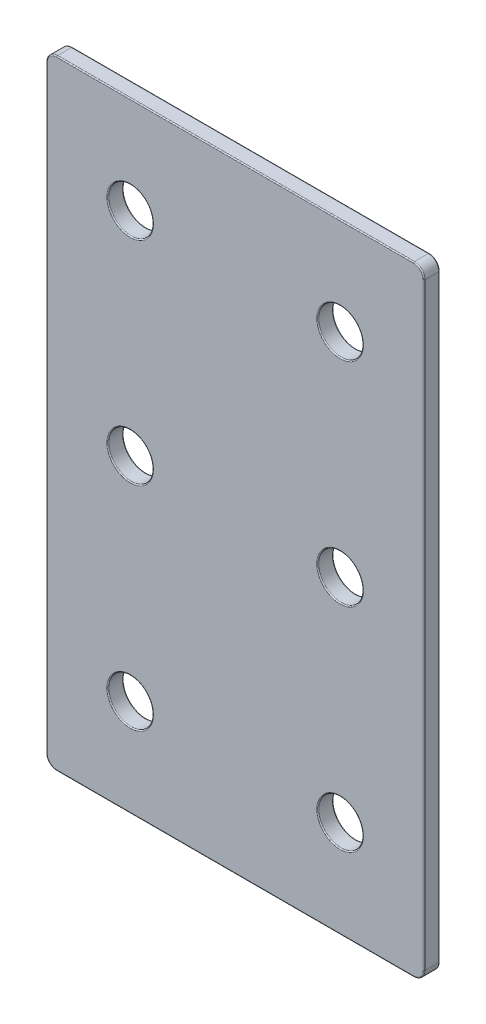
SolidWorks part; units mm, degrees
ref_plane "前视基准面" through (0, 0, 0) normal (0, 0, 1) x (1, 0, 0)
ref_plane "上视基准面" through (0, 0, 0) normal (0, 1, 0) x (1, 0, 0)
ref_plane "右视基准面" through (0, 0, 0) normal (1, 0, 0) x (0, 0, -1)
sketch "草图1" plane through (0, 0, 0) normal (0, 0, 1) x (1, 0, 0)
  line L1 (-36, 59) -> (36, 59)
  line L2 (-36, 59) -> (-36, -59)
  line L3 (-36, -59) -> (36, -59)
  line L4 (36, 59) -> (36, -59)
  line L5 (-36, 59) -> (36, -59) construction
  line L6 (-36, -59) -> (36, 59) construction
  point P0 (0, 0)
  dimension "D1" = 72
  dimension "D2" = 118
extrude "凸台-拉伸1" add sketch "草图1" along normal mid plane 3
sketch "草图2" plane through (0, 0, 1.5) normal (0, 0, 1) x (1, 0, 0)
  line L0 (0, 0) -> (0, 97.38) construction
  line L1 (0, 97.38) -> (0, -110.8953) construction
  line L2 (0, 0) -> (106.197, 0) construction
  line L3 (106.197, 0) -> (-81.6285, 0) construction
  circle A0 centre (20, 0) radius 4.25
  circle A1 centre (20, 40.5) radius 4.25
  circle A2 centre (20, -40.5) radius 4.25
  circle A3 centre (-20, -40.5) radius 4.25
  circle A4 centre (-20, 0) radius 4.25
  circle A5 centre (-20, 40.5) radius 4.25
  dimension "D1" = 8.5
  dimension "D3" = 20
  dimension "D4" = 8.5
  dimension "D2" = 20
  dimension "D5" = 18.5
extrude "切除-拉伸1" cut sketch "草图2" against normal blind 3
fillet "圆角1" radius 2 4 edges at (-36, -59, 0) (36, -59, 0) (-36, 59, 0) (36, 59, 0)
fillet "圆角2" radius 0.2 28 edges at (35.4142, -58.4142, -1.5) (36, 0, -1.5) (35.4142, 58.4142, -1.5) (0, 59, -1.5) (-35.4142, 58.4142, -1.5) (-36, 0, -1.5) (-35.4142, -58.4142, -1.5) (0, -59, -1.5) (24.25, 0, -1.5) (24.25, 40.5, -1.5) (15.75, -40.5, -1.5) (-15.75, -40.5, -1.5) (-24.25, 0, -1.5) (-24.25, 40.5, -1.5) (-35.4142, 58.4142, 1.5) (0, 59, 1.5) (35.4142, 58.4142, 1.5) (36, 0, 1.5) (35.4142, -58.4142, 1.5) (0, -59, 1.5) (-35.4142, -58.4142, 1.5) (-36, 0, 1.5) (24.25, 0, 1.5) (24.25, 40.5, 1.5) (15.75, -40.5, 1.5) (-15.75, -40.5, 1.5) (-24.25, 0, 1.5) (-24.25, 40.5, 1.5)
